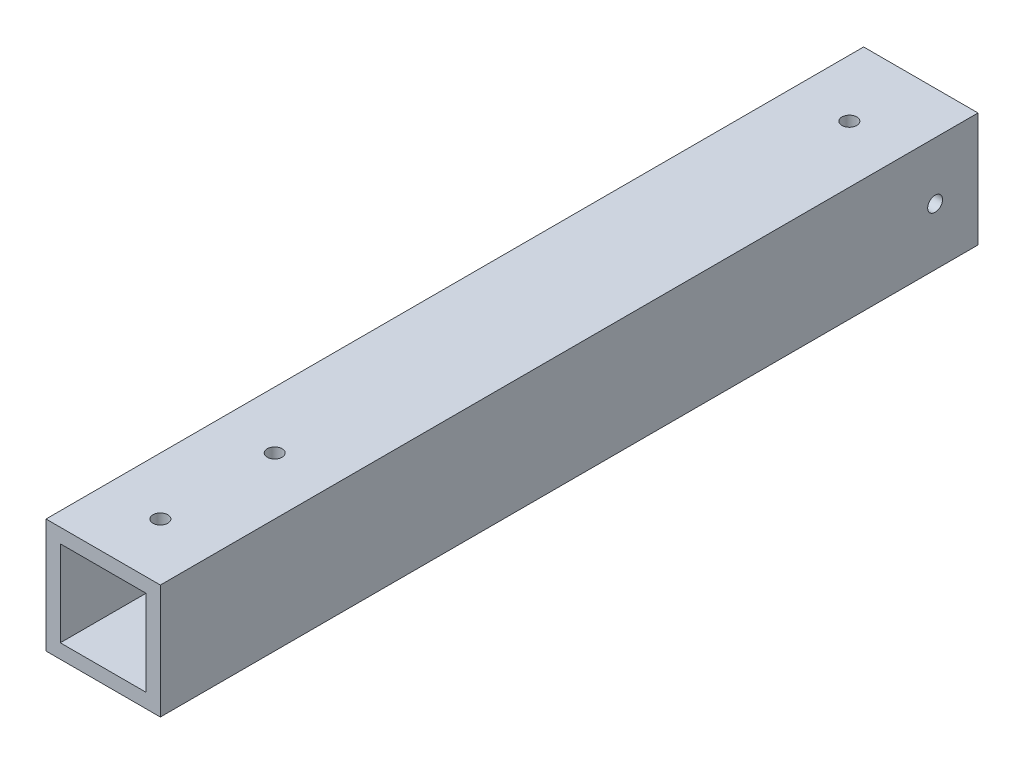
SolidWorks part; units mm, degrees
ref_plane "Front Plane" through (0, 0, 0) normal (0, 0, 1) x (1, 0, 0)
ref_plane "Top Plane" through (0, 0, 0) normal (0, 1, 0) x (1, 0, 0)
ref_plane "Right Plane" through (0, 0, 0) normal (1, 0, 0) x (0, 0, -1)
sketch "Sketch1" plane through (0, 0, 0) normal (0, 0, 1) x (1, 0, 0)
  line L1 (0, 0) -> (50.8, 0)
  line L2 (0, 0) -> (0, 50.8)
  line L3 (0, 50.8) -> (50.8, 50.8)
  line L4 (50.8, 0) -> (50.8, 50.8)
  line L5 (6.35, 6.35) -> (44.45, 6.35)
  line L6 (6.35, 6.35) -> (6.35, 44.45)
  line L7 (6.35, 44.45) -> (44.45, 44.45)
  line L8 (44.45, 6.35) -> (44.45, 44.45)
  dimension "D1" = 50.8
  dimension "D2" = 50.8
  dimension "D3" = 38.1
  dimension "D4" = 6.35
  dimension "D5" = 38.1
  dimension "D6" = 6.35
extrude "Boss-Extrude1" add sketch "Sketch1" against normal blind 363.22
sketch "Sketch3" plane through (0, 50.8, 0) normal (0, 1, 0) x (1, 0, 0)
  line L0 (50.8, 0) -> (0, 0) construction
  circle A0 centre (25.4, 25.4) radius 3.302
  circle A1 centre (25.4, 76.2) radius 3.302
  dimension "D1" = 6.604
  dimension "D2" = 25.4
  dimension "D3" = 50.8
extrude "hold down" cut sketch "Sketch3" against normal through all
sketch "Sketch4" plane through (50.8, 0, 0) normal (1, 0, 0) x (0, 0, -1)
  line L2 (363.22, 0) -> (363.22, 50.8) construction
  circle A1 centre (344.17, 25.4) radius 3.302
  dimension "D1" = 6.604
  dimension "D2" = 19.05
extrude "Cut-Extrude1" cut sketch "Sketch4" against normal through all
sketch "Sketch5" plane through (0, 50.8, 0) normal (0, 1, 0) x (1, 0, 0)
  line L0 (50.8, 363.22) -> (0, 363.22) construction
  circle A0 centre (25.4, 331.47) radius 3.302
  dimension "D1" = 6.604
  dimension "D2" = 31.75
extrude "Cut-Extrude2" cut sketch "Sketch5" against normal through all
